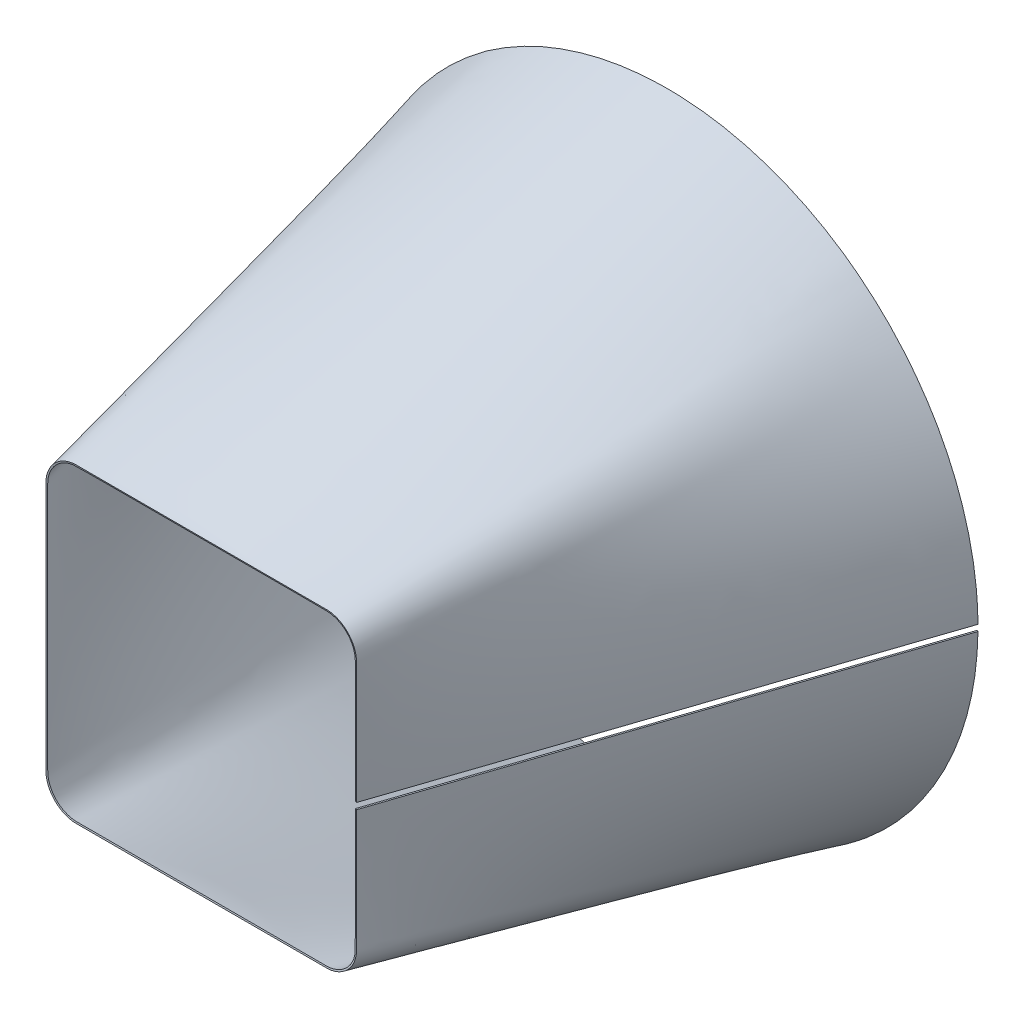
SolidWorks part; units mm, degrees
ref_plane "Front" through (0, 0, 0) normal (0, 0, 1) x (1, 0, 0)
ref_plane "Top" through (0, 0, 0) normal (0, 1, 0) x (1, 0, 0)
ref_plane "Right" through (0, 0, 0) normal (1, 0, 0) x (0, 0, -1)
sketch "Sketch1" plane through (0, 0, 0) normal (0, 0, 1) x (1, 0, 0)
  line L1 (10, 0) -> (90, 0)
  line L2 (0, 10) -> (0, 90)
  line L3 (10, 100) -> (90, 100)
  line L4 (100, 10) -> (100, 49)
  line L7 (100, 51) -> (100, 90)
  arc A0 (90, 100) -> (100, 90) centre (90, 90) cw
  arc A1 (0, 90) -> (10, 100) centre (10, 90) cw
  arc A2 (10, 0) -> (0, 10) centre (10, 10) cw
  arc A3 (90, 0) -> (100, 10) centre (90, 10) ccw
  dimension "D4" = 10
  dimension "D1" = 100
  dimension "D2" = 2
  dimension "D3" = 49
ref_plane "Plane1" through (0, 0, -150) normal (0, 0, 1) x (1, 0, 0)
sketch "Sketch2" plane through (0, 0, -150) normal (0, 0, 1) x (1, 0, 0)
  arc A0 (149.9978, 50.6667) -> (149.9911, 48.6667) centre (50, 50) ccw
  dimension "D3" = 200
  dimension "D1" = 50
  dimension "D2" = 50
  dimension "D4" = 2
sheet metal parameters "Sheet-Metal1" thickness 0.5 parameters "D1"=0.7366
lofted bend "Lofted Bends1" thickness 0.5 parameters "D1"=0, "D12"=0.5
other "Freeform Bend1" parameters "D1"=1000, "D4"=57.296, "D5"=1
flat pattern "Flat-Pattern1"
sketch "Bend-Lines1" plane through (0, 0, 0) normal (0, 1, 0) x (-1, 0, 0)
other "Flatten-<Freeform Bend1>1"
